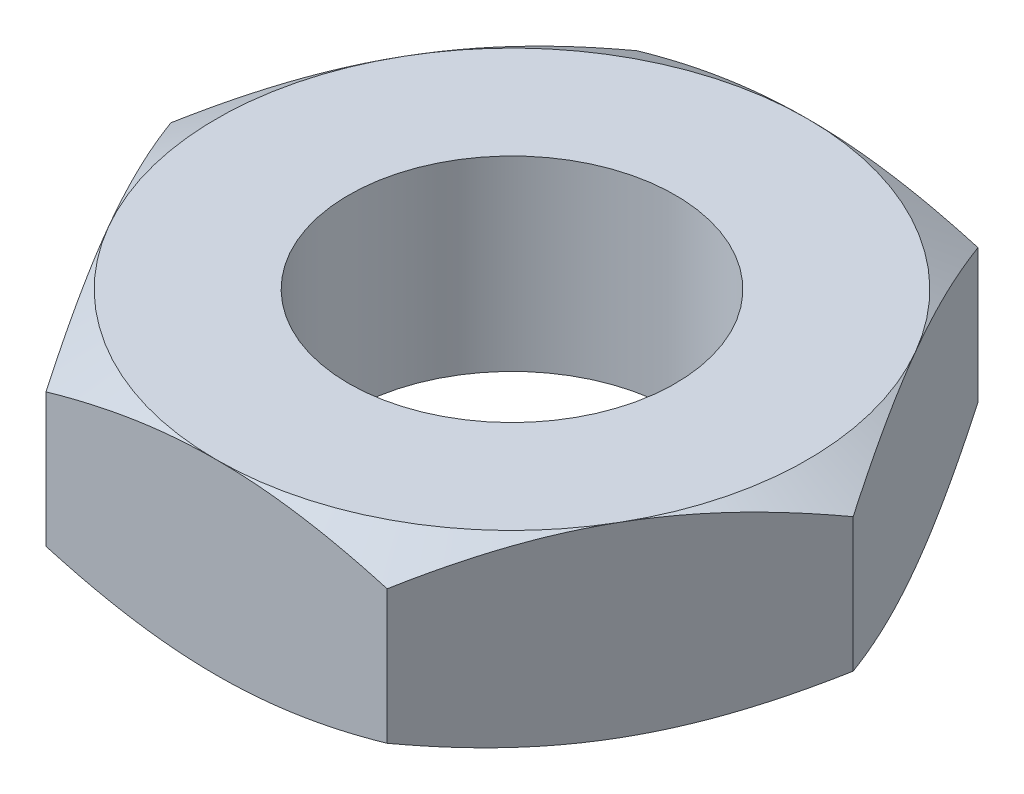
SolidWorks part; units mm, degrees
ref_plane "Front Plane" through (0, 0, 0) normal (0, 0, 1) x (1, 0, 0)
ref_plane "Top Plane" through (0, 0, 0) normal (0, 1, 0) x (1, 0, 0)
ref_plane "Right Plane" through (0, 0, 0) normal (1, 0, 0) x (0, 0, -1)
sketch "Sketch1" plane through (0, 0, 0) normal (0, 1, 0) x (1, 0, 0)
  line L1 (5.4848, -9.5) -> (10.9697, 0)
  line L2 (10.9697, 0) -> (5.4848, 9.5)
  line L3 (5.4848, 9.5) -> (-5.4848, 9.5)
  line L4 (-5.4848, 9.5) -> (-10.9697, 0)
  line L5 (-10.9697, 0) -> (-5.4848, -9.5)
  line L6 (-5.4848, -9.5) -> (5.4848, -9.5)
  circle A0 centre (0, 0) radius 9.5 construction
  dimension "D1" = 19
extrude "Extrude1" add sketch "Sketch1" along normal blind 6
sketch "Sketch2" plane through (0, 0, 0) normal (1, 0, 0) x (0, 0, -1)
  line L0 (-9.5, 6) -> (-12.9641, 4)
  line L1 (-12.9641, 4) -> (-12.9641, 6)
  line L2 (-12.9641, 6) -> (-9.5, 6)
  line L3 (-9.5, 3) -> (0, 3) construction
  line L4 (-9.5, 6) -> (-9.5, 0) construction
  line L5 (0, 6) -> (0, 0) construction
  line L6 (-12.9641, 0) -> (-9.5, 0)
  line L7 (-12.9641, 2) -> (-12.9641, 0)
  line L8 (-9.5, 0) -> (-12.9641, 2)
  line L9 (0, 0) -> (0, 9.1824) construction
  dimension "D1" = 30
  dimension "D2" = 2
revolve "Cut-Revolve1" cut sketch "Sketch2" angle 360 about L9
hole_wizard "M12x1.5 Tapped Hole1" positions "Sketch4" profile "Sketch3" tap size "M12x1.5" standard "Ansi Metric"
sketch "Sketch4" plane through (0, 6, 0) normal (0, 1, 0) x (-1, 0, 0)
  point P0 (0, 0)
sketch "Sketch3" plane through (0, 6, 0) normal (1, 0, 0) x (0, 0, 1)
  line L0 (0, 0) -> (0, 6)
  line L1 (0, 6) -> (5.25, 6)
  line L2 (5.25, 6) -> (5.25, 0)
  line L5 (5.25, 0) -> (0, 0)
  line L11 (0, -6.35) -> (0, 107.95) construction
  dimension "Thru Tap Drill Dia." = 10.5
  dimension "Thru Tap Drill Depth" = 6
